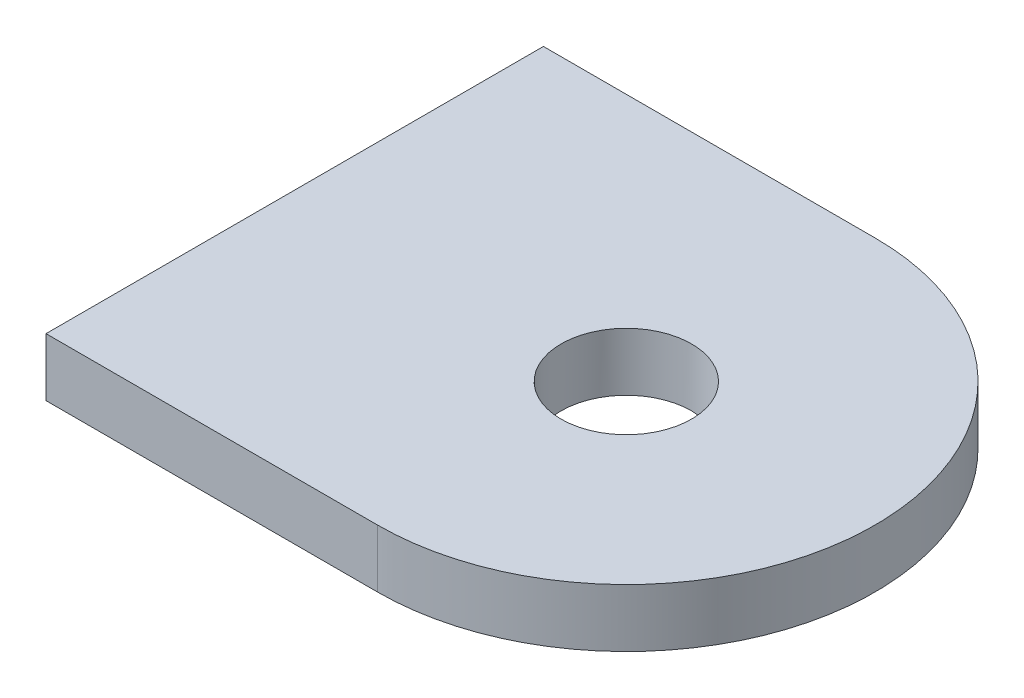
SolidWorks part; units mm, degrees
ref_plane "Front Plane" through (0, 0, 0) normal (0, 0, 1) x (1, 0, 0)
ref_plane "Top Plane" through (0, 0, 0) normal (0, 1, 0) x (1, 0, 0)
ref_plane "Right Plane" through (0, 0, 0) normal (1, 0, 0) x (0, 0, -1)
sketch "Sketch1"
  dimension "D1" = 76.2
  dimension "D2" = 50.8
extrude "Extrude1" add sketch "Sketch1" along normal blind 8.89
extrude "Cut-Extrude4" cut sketch "Sketch5" against normal blind 42.926
sketch "Sketch5"
  dimension "D1" = 9.99
